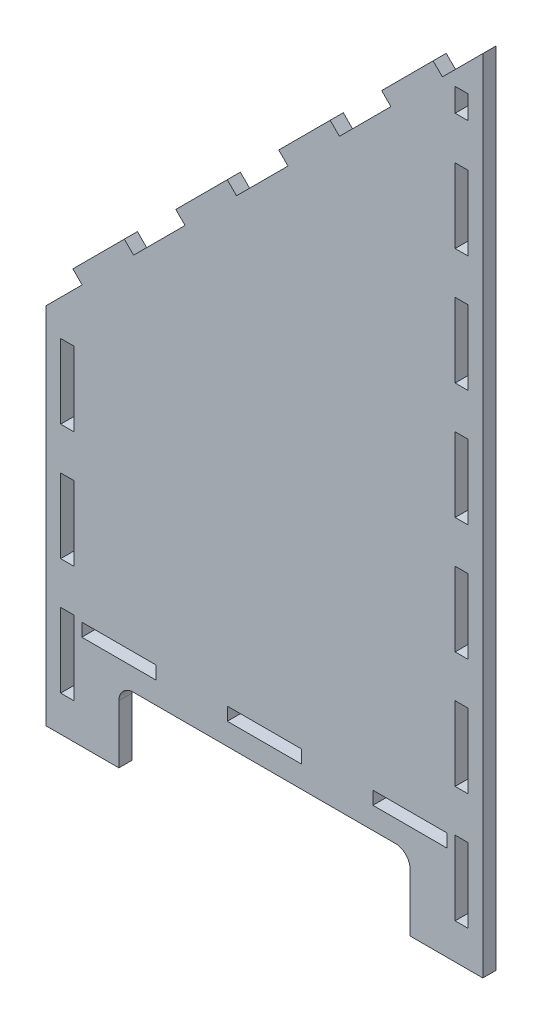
SolidWorks part; units mm, degrees
ref_plane "Front Plane" through (0, 0, 0) normal (0, 0, 1) x (1, 0, 0)
ref_plane "Top Plane" through (0, 0, 0) normal (0, 1, 0) x (1, 0, 0)
ref_plane "Right Plane" through (0, 0, 0) normal (1, 0, 0) x (0, 0, -1)
sketch "Sketch1" plane through (0, 0, 0) normal (0, 0, 1) x (1, 0, 0)
  line L0 (60, 0) -> (240, 0)
  line L1 (300, 0) -> (300, 500)
  line L2 (300, 500) -> (272.2361, 472.2361)
  line L3 (0, 200) -> (0, 0)
  line L4 (24.7487, 224.7487) -> (18.3848, 231.1127)
  line L5 (18.3848, 231.1127) -> (53.7401, 266.468)
  line L6 (53.7401, 266.468) -> (60.1041, 260.1041)
  line L7 (89.0955, 301.8234) -> (124.4508, 337.1787)
  line L8 (95.4594, 295.4594) -> (89.0955, 301.8234)
  line L9 (124.4508, 337.1787) -> (130.8148, 330.8148)
  line L10 (159.8061, 372.5341) -> (195.1615, 407.8894)
  line L11 (166.1701, 366.1701) -> (159.8061, 372.5341)
  line L12 (195.1615, 407.8894) -> (201.5254, 401.5254)
  line L13 (230.5168, 443.2447) -> (265.8721, 478.6001)
  line L14 (236.8808, 436.8808) -> (230.5168, 443.2447)
  line L15 (265.8721, 478.6001) -> (272.2361, 472.2361)
  line L16 (24.7487, 224.7487) -> (0, 200)
  line L17 (95.4594, 295.4594) -> (60.1041, 260.1041)
  line L18 (166.1701, 366.1701) -> (130.8148, 330.8148)
  line L19 (236.8808, 436.8808) -> (201.5254, 401.5254)
  line L20 (0, 0) -> (0, -50)
  line L21 (0, -50) -> (50, -50)
  line L22 (50, -50) -> (50, -10)
  line L23 (300, 0) -> (300, -50)
  line L24 (300, -50) -> (250, -50)
  line L25 (250, -10) -> (250, -50)
  arc A0 (60, 0) -> (50, -10) centre (60, -10) ccw
  arc A1 (240, 0) -> (250, -10) centre (240, -10) cw
  dimension "D9" = 10
  dimension "D2" = 10
  dimension "D3" = 45
  dimension "D4" = 35
  dimension "D5" = 50
  dimension "D6" = 9
  dimension "D8" = 50
  dimension "D10" = 50
  dimension "D7" = 4
extrude "Boss-Extrude1" add sketch "Sketch1" along normal blind 9
sketch "Sketch2" plane through (0, 0, 0) normal (0, 0, 1) x (1, 0, 0)
  line L0 (0, 200) -> (0, -50) construction
  line L1 (24.5, 24) -> (75.5, 24)
  line L2 (24.5, 24) -> (24.5, 15)
  line L3 (24.5, 15) -> (75.5, 15)
  line L4 (75.5, 24) -> (75.5, 15)
  line L5 (60, 0) -> (240, 0) construction
  point P4 (24.5, 19.5)
  dimension "D1" = 51
  dimension "D2" = 9
  dimension "D3" = 24.5
  dimension "D4" = 15
extrude "Cut-Extrude2" cut sketch "Sketch2" along normal through all
sketch "Sketch4" plane through (0, 0, 9) normal (0, 0, 1) x (1, 0, 0)
  line L0 (0, -50) -> (50, -50) construction
  line L1 (10, 25.5) -> (19, 25.5)
  line L2 (10, 25.5) -> (10, -25.5)
  line L3 (10, -25.5) -> (19, -25.5)
  line L4 (19, 25.5) -> (19, -25.5)
  line L5 (0, 200) -> (0, -50) construction
  dimension "D1" = 51
  dimension "D2" = 9
  dimension "D3" = 24.5
  dimension "D4" = 10
extrude "Cut-Extrude4" cut sketch "Sketch4" against normal through all
sketch "Sketch5" plane through (0, 0, 9) normal (0, 0, 1) x (1, 0, 0)
  line L0 (250, -50) -> (300, -50) construction
  line L1 (281, 25.5) -> (290, 25.5)
  line L2 (281, 25.5) -> (281, -25.5)
  line L3 (281, -25.5) -> (290, -25.5)
  line L4 (290, 25.5) -> (290, -25.5)
  line L5 (300, -50) -> (300, 500) construction
  point P6 (290, 0)
  dimension "D1" = 51
  dimension "D2" = 9
  dimension "D3" = 24.5
  dimension "D4" = 10
extrude "Cut-Extrude5" cut sketch "Sketch5" against normal through all
pattern_linear "LPattern6" count 3 spacing 100 along (1, 0, 0) of "Cut-Extrude2"
pattern_linear "LPattern7" count 3 spacing 80 along (0, 1, 0) of "Cut-Extrude4"
pattern_linear "LPattern8" count 6 spacing 80 along (0, 1, 0) of "Cut-Extrude5"
sketch "Sketch7" plane through (0, 0, 9) normal (0, 0, 1) x (1, 0, 0)
  line L0 (300, -50) -> (300, 500) construction
  line L1 (281, 471) -> (290, 471)
  line L2 (281, 471) -> (281, 455)
  line L3 (281, 455) -> (290, 455)
  line L4 (290, 471) -> (290, 455)
  dimension "D1" = 16
  dimension "D2" = 9
  dimension "D3" = 10
  dimension "D4" = 29.5
extrude "Cut-Extrude6" cut sketch "Sketch7" against normal through all
